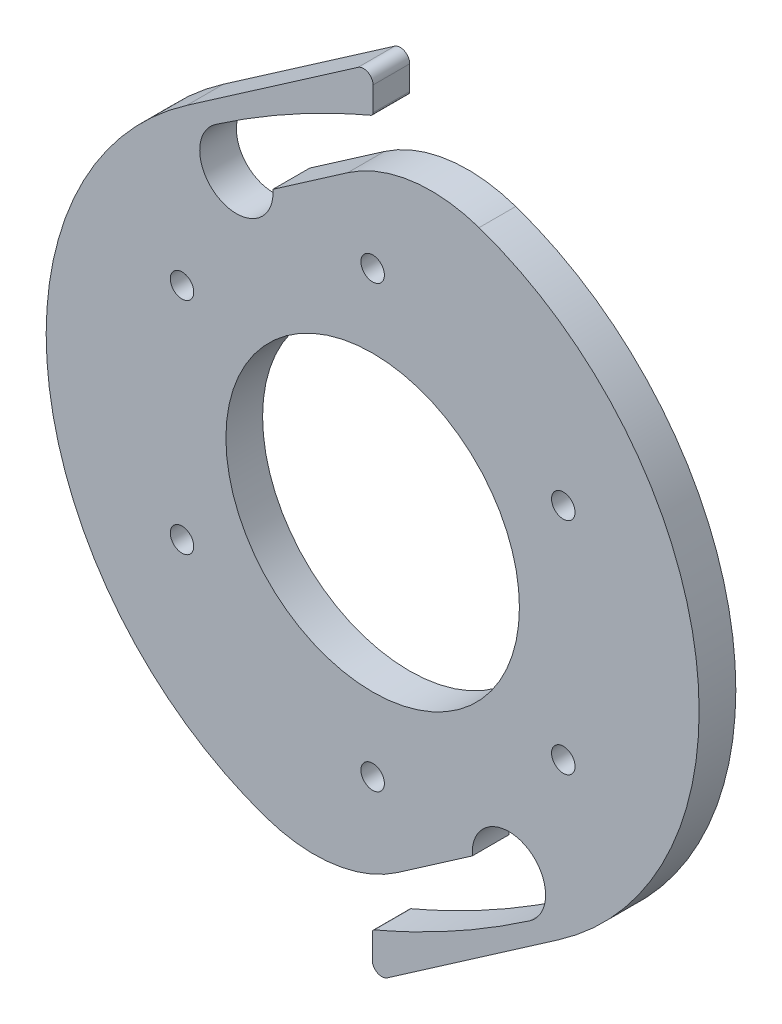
SolidWorks part; units mm, degrees
ref_plane "Plane1" through (0, 0, 0) normal (0, 0, 1) x (1, 0, 0)
ref_plane "Plane2" through (0, 0, 0) normal (0, 1, 0) x (1, 0, 0)
ref_plane "Plane3" through (0, 0, 0) normal (1, 0, 0) x (0, 0, -1)
sketch "Esquisse3" plane through (0, 0, 0) normal (0, 0, 1) x (1, 0, 0)
  line L0 (0, -117.2345) -> (0, 37.3115) construction
  line L1 (8.3441, 59.8932) -> (-41.999, 25.0381) construction
  line L2 (-25.3269, 36.581) -> (-1.989, 52.7391)
  line L3 (-71.233, 0) -> (80.1555, 0) construction
  line L4 (-24.0296, 31.3978) -> (11.1388, 55.7467) construction
  line L5 (-22.6275, 29.3279) -> (12.8626, 53.8995) construction
  line L6 (-22.4662, 26.3988) -> (16.2221, 53.1847) construction
  line L7 (-11.9825, 22.6681) -> (-25.1516, 41.6889) construction
  line L8 (0.051, 60.3649) -> (0.051, 45.8807) construction
  line L9 (-3.4008, 39.5987) -> (-13.5809, 32.5505)
  line L10 (0.051, 51.6702) -> (0.051, 48.4008)
  line L11 (25.3269, -36.581) -> (1.989, -52.7391)
  line L12 (-0.051, -51.6702) -> (-0.051, -48.4008)
  line L13 (3.4008, -39.5987) -> (13.5809, -32.5505)
  line L57 (0.3185, 51.9641) -> (0.5972, 50.4776) construction
  line L58 (1.178, 50.0778) -> (11.355, 51.9267) construction
  line L59 (13.2314, 50.2524) -> (13.1317, 48.7432) construction
  line L60 (13.5948, 48.2115) -> (23.9119, 47.4714) construction
  line L61 (25.313, 45.3831) -> (24.8411, 43.9461) construction
  line L62 (25.1574, 43.316) -> (34.9663, 40.0334) construction
  line L63 (35.8041, 37.6622) -> (34.9896, 36.3877) construction
  line L64 (35.1393, 35.6987) -> (43.8237, 30.0799) construction
  line L65 (44.0454, 27.5749) -> (42.9396, 26.543) construction
  line L66 (42.9133, 25.8384) -> (49.9274, 18.2363) construction
  line L67 (49.5192, 15.7549) -> (48.1916, 15.0305) construction
  line L68 (47.9908, 14.3545) -> (52.8941, 5.247) construction
  line L69 (51.8816, 2.945) -> (50.4155, 2.5735) construction
  line L70 (50.0529, 1.9687) -> (52.5372, -8.0721) construction
  line L71 (50.984, -10.0499) -> (49.4716, -10.0452) construction
  line L72 (48.97, -10.5408) -> (48.8792, -20.884) construction
  line L73 (46.883, -22.4134) -> (45.4192, -22.0327) construction
  line L74 (44.8101, -22.388) -> (42.1499, -32.3836) construction
  line L75 (39.8361, -33.3686) -> (38.513, -32.6358) construction
  line L76 (37.8347, -32.8284) -> (32.7722, -41.8485) construction
  line L77 (30.2861, -42.2271) -> (29.1868, -41.1882) construction
  line L78 (28.4819, -41.2062) -> (21.3353, -48.6839) construction
  line L79 (18.8332, -48.4323) -> (18.0268, -47.1527) construction
  line L80 (17.3396, -46.9948) -> (8.5579, -52.4602) construction
  line L81 (6.1969, -51.5943) -> (5.734, -50.1544) construction
  line L82 (5.1077, -49.8305) -> (-4.7573, -52.9404) construction
  line L83 (-6.8288, -51.5145) -> (-6.919, -50.0047) construction
  line L84 (-7.4451, -49.5352) -> (-17.7736, -50.094) construction
  line L85 (-19.4254, -48.1978) -> (-19.1373, -46.713) construction
  line L86 (-19.5301, -46.1275) -> (-29.6731, -44.1001) construction
  line L87 (-30.8014, -41.8527) -> (-30.1531, -40.4862) construction
  line L88 (-30.388, -39.8213) -> (-39.7081, -35.3352) construction
  line L89 (-40.2421, -32.8778) -> (-39.2743, -31.7155) construction
  line L90 (-39.3365, -31.0131) -> (-47.2481, -24.3501) construction
  line L91 (-47.1542, -21.8371) -> (-45.9277, -20.9519) construction
  line L92 (-45.8133, -20.2562) -> (-51.8194, -11.835) construction
  line L93 (-51.1034, -9.4243) -> (-49.6954, -8.8719) construction
  line L94 (-49.4115, -8.2265) -> (-53.1346, 1.4238) construction
  line L95 (-51.8416, 3.5807) -> (-50.3405, 3.7655) construction
  line L96 (-49.905, 4.3201) -> (-51.1112, 14.5931) construction
  line L97 (-49.3224, 16.3607) -> (-47.8225, 16.1664) construction
  line L98 (-47.2628, 16.5952) -> (-45.8763, 26.8455) construction
  line L99 (-43.7041, 28.1127) -> (-42.2996, 27.5515) construction
  line L100 (-41.6508, 27.8276) -> (-37.7588, 37.411) construction
  line L101 (-35.3398, 38.0982) -> (-34.1189, 37.2054) construction
  line L102 (-33.4219, 37.3115) -> (-27.2688, 45.6259) construction
  line L103 (-24.7548, 45.6899) -> (-23.7944, 44.5215) construction
  line L104 (-23.0928, 44.451) -> (-15.0654, 50.974) construction
  line L105 (-12.6145, 50.4108) -> (-11.9748, 49.0402) construction
  line L106 (-11.3128, 48.7974) -> (-1.9154, 53.1192) construction
  arc A0 (0.051, 51.6702) -> (-1.989, 52.7391) centre (-1.249, 51.6702) ccw
  arc A1 (44.493, 0) -> (14.5031, 42.0629) centre (0, 0) ccw
  arc A2 (-25.3269, 36.581) -> (-44.493, 0) centre (0, 0) ccw
  arc A3 (-21.4132, 36.2894) -> (-13.5809, 32.5505) centre (-18.5671, 32.1785) ccw
  arc A4 (0.051, 48.4008) -> (-0.2528, 47.9409) centre (-0.449, 48.4008) cw
  arc A5 (14.5031, 42.0629) -> (-3.4008, 39.5987) centre (7.9838, 23.1552) ccw
  arc A6 (25.3269, -36.581) -> (44.493, 0) centre (0, 0) ccw
  arc A7 (-0.051, -51.6702) -> (1.989, -52.7391) centre (1.249, -51.6702) ccw
  arc A8 (-0.051, -48.4008) -> (0.2528, -47.9409) centre (0.449, -48.4008) cw
  arc A9 (21.4132, -36.2894) -> (13.5809, -32.5505) centre (18.5671, -32.1785) ccw
  circle A10 centre (0, 0) radius 20
  circle A11 centre (0, 0) radius 30 construction
  circle A12 centre (0, 30) radius 1.6
  circle A13 centre (25.9808, 15) radius 1.6
  circle A14 centre (25.9808, -15) radius 1.6
  circle A15 centre (0, -30) radius 1.6
  circle A16 centre (-25.9808, -15) radius 1.6
  circle A17 centre (-25.9808, 15) radius 1.6
  arc A18 (-14.5031, -42.0629) -> (3.4008, -39.5987) centre (-7.9838, -23.1552) ccw
  arc A19 (-44.493, 0) -> (-14.5031, -42.0629) centre (0, 0) ccw
  arc A207 (0.5972, 50.4776) -> (1.178, 50.0778) centre (1.0886, 50.5697) ccw construction
  arc A208 (13.1317, 48.7432) -> (13.5948, 48.2115) centre (13.6306, 48.7102) ccw construction
  arc A209 (24.8411, 43.9461) -> (25.1574, 43.316) centre (25.3161, 43.7901) ccw construction
  arc A210 (34.9896, 36.3877) -> (35.1393, 35.6987) centre (35.4109, 36.1185) ccw construction
  arc A211 (42.9396, 26.543) -> (42.9133, 25.8384) centre (43.2807, 26.1774) ccw construction
  arc A212 (48.1916, 15.0305) -> (47.9908, 14.3545) centre (48.4311, 14.5915) ccw construction
  arc A213 (50.4155, 2.5735) -> (50.0529, 1.9687) centre (50.5383, 2.0888) ccw construction
  arc A214 (49.4716, -10.0452) -> (48.97, -10.5408) centre (49.47, -10.5452) ccw construction
  arc A215 (45.4192, -22.0327) -> (44.8101, -22.388) centre (45.2933, -22.5166) ccw construction
  arc A216 (38.513, -32.6358) -> (37.8347, -32.8284) centre (38.2707, -33.0731) ccw construction
  arc A217 (29.1868, -41.1882) -> (28.4819, -41.2062) centre (28.8434, -41.5516) ccw construction
  arc A218 (18.0268, -47.1527) -> (17.3396, -46.9948) centre (17.6038, -47.4193) ccw construction
  arc A219 (5.734, -50.1544) -> (5.1077, -49.8305) centre (5.258, -50.3074) ccw construction
  arc A220 (-6.919, -50.0047) -> (-7.4451, -49.5352) centre (-7.4181, -50.0345) ccw construction
  arc A221 (-19.1373, -46.713) -> (-19.5301, -46.1275) centre (-19.6281, -46.6178) ccw construction
  arc A222 (-30.1531, -40.4862) -> (-30.388, -39.8213) centre (-30.6048, -40.2719) ccw construction
  arc A223 (-39.2743, -31.7155) -> (-39.3365, -31.0131) centre (-39.6585, -31.3955) ccw construction
  arc A224 (-45.9277, -20.9519) -> (-45.8133, -20.2562) centre (-46.2204, -20.5465) ccw construction
  arc A225 (-49.6954, -8.8719) -> (-49.4115, -8.2265) centre (-49.878, -8.4065) ccw construction
  arc A226 (-50.3405, 3.7655) -> (-49.905, 4.3201) centre (-50.4016, 4.2618) ccw construction
  arc A227 (-47.8225, 16.1664) -> (-47.2628, 16.5952) centre (-47.7582, 16.6622) ccw construction
  arc A228 (-42.2996, 27.5515) -> (-41.6508, 27.8276) centre (-42.1141, 28.0158) ccw construction
  arc A229 (-34.1189, 37.2054) -> (-33.4219, 37.3115) centre (-33.8238, 37.6089) ccw construction
  arc A230 (-23.7944, 44.5215) -> (-23.0928, 44.451) centre (-23.4082, 44.839) ccw construction
  arc A231 (-11.9748, 49.0402) -> (-11.3128, 48.7974) centre (-11.5217, 49.2517) ccw construction
  arc A232 (-37.7588, 37.411) -> (-35.3398, 38.0982) centre (-36.2812, 36.811) cw construction
  arc A233 (-45.8763, 26.8455) -> (-43.7041, 28.1127) centre (-44.2959, 26.6317) cw construction
  arc A234 (-51.1112, 14.5931) -> (-49.3224, 16.3607) centre (-49.5273, 14.7791) cw construction
  arc A235 (-53.1346, 1.4238) -> (-51.8416, 3.5807) centre (-51.6467, 1.9978) cw construction
  arc A236 (-51.8194, -11.835) -> (-51.1034, -9.4243) centre (-50.521, -10.9089) cw construction
  arc A237 (-47.2481, -24.3501) -> (-47.1542, -21.8371) centre (-46.2208, -23.1303) cw construction
  arc A238 (-39.7081, -35.3352) -> (-40.2421, -32.8778) centre (-39.0164, -33.8982) cw construction
  arc A239 (-29.6731, -44.1001) -> (-30.8014, -41.8527) centre (-29.3605, -42.5363) cw construction
  arc A240 (-17.7736, -50.094) -> (-19.4254, -48.1978) centre (-17.8598, -48.5016) cw construction
  arc A241 (-4.7573, -52.9404) -> (-6.8288, -51.5145) centre (-5.2368, -51.4193) cw construction
  arc A242 (8.5579, -52.4602) -> (6.1969, -51.5943) centre (7.7152, -51.1063) cw construction
  arc A243 (21.3353, -48.6839) -> (18.8332, -48.4323) centre (20.1824, -47.582) cw construction
  arc A244 (32.7722, -41.8485) -> (30.2861, -42.2271) centre (31.3815, -41.0679) cw construction
  arc A245 (42.1499, -32.3836) -> (39.8361, -33.3686) centre (40.6088, -31.9735) cw construction
  arc A246 (48.8792, -20.884) -> (46.883, -22.4134) centre (47.2844, -20.87) cw construction
  arc A247 (52.5372, -8.0721) -> (50.984, -10.0499) centre (50.9891, -8.4551) cw construction
  arc A248 (52.8941, 5.247) -> (51.8816, 2.945) centre (51.4898, 4.491) cw construction
  arc A249 (49.9274, 18.2363) -> (49.5192, 15.7549) centre (48.7553, 17.1549) cw construction
  arc A250 (43.8237, 30.0799) -> (44.0454, 27.5749) centre (42.9574, 28.7409) cw construction
  arc A251 (34.9663, 40.0334) -> (35.8041, 37.6622) centre (34.4602, 38.521) cw construction
  arc A252 (-27.2688, 45.6259) -> (-24.7548, 45.6899) centre (-25.9869, 44.6773) cw construction
  arc A253 (-15.0654, 50.974) -> (-12.6145, 50.4108) centre (-14.0596, 49.7363) cw construction
  arc A254 (23.9119, 47.4714) -> (25.313, 45.3831) centre (23.7978, 45.8807) cw construction
  arc A255 (11.355, 51.9267) -> (13.2314, 50.2524) centre (11.6401, 50.3575) cw construction
  arc A256 (0.3185, 51.9641) -> (-1.9154, 53.1192) centre (-1.249, 51.6702) ccw construction
  spline S0 degree 3 poles (-21.4132, 36.2894) (-14.7028, 40.9019) (-7.6493, 44.7857) (-0.2528, 47.9409) knots 0 0 0 0 0.807146 0.807146 0.807146 0.807146
  spline S1 degree 3 poles (21.4132, -36.2894) (14.7028, -40.9019) (7.6493, -44.7857) (0.2528, -47.9409) knots 0 0 0 0 0.807146 0.807146 0.807146 0.807146
  point P35 (3.4722, 44.3573)
  point P472 (0.6888, 49.9889)
  dimension "D1" = 5
  dimension "D3" = 2.5
  dimension "D4" = 5
  dimension "D9" = 25
  dimension "D2" = 20
  dimension "D5" = 90
extrude "Boss.-Extru.1" add sketch "Esquisse3" along normal blind 5
